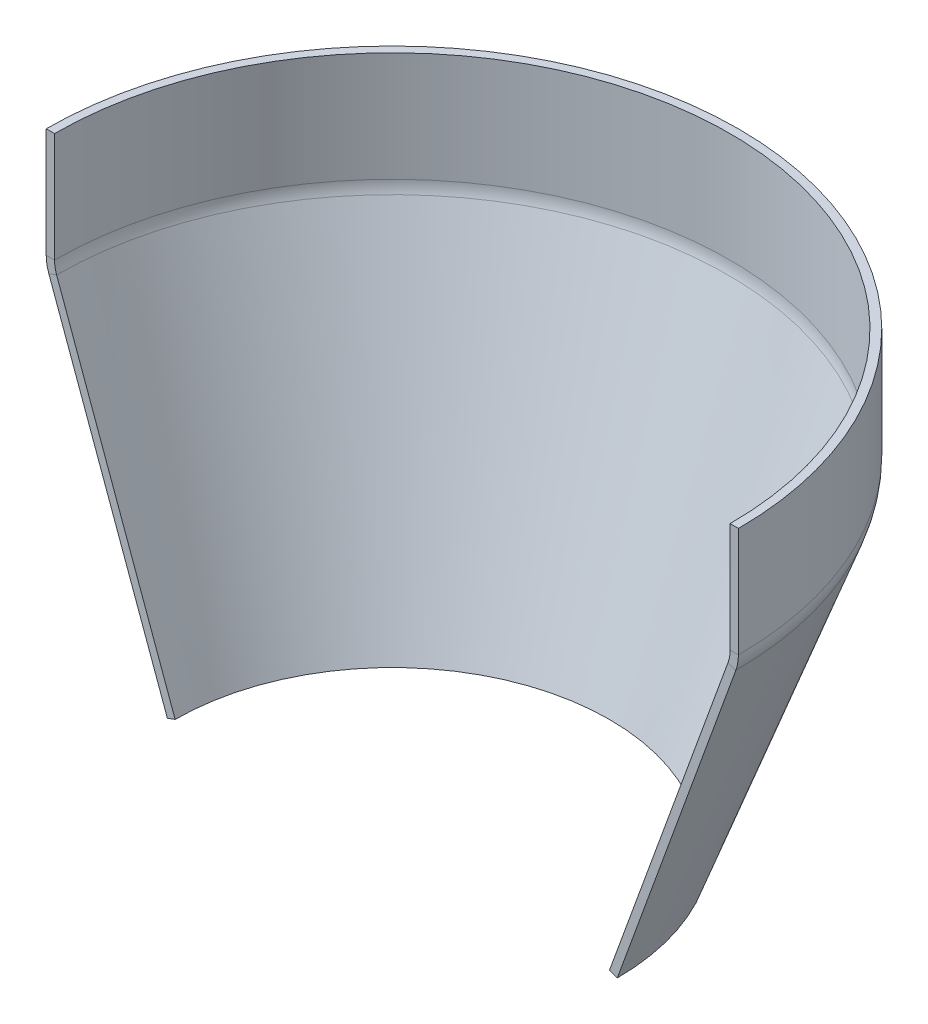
SolidWorks part; units mm, degrees
ref_plane "Front Plane" through (0, 0, 0) normal (0, 0, 1) x (1, 0, 0)
ref_plane "Top Plane" through (0, 0, 0) normal (0, 1, 0) x (1, 0, 0)
ref_plane "Right Plane" through (0, 0, 0) normal (1, 0, 0) x (0, 0, -1)
sketch "Sketch1" plane through (0, 0, 0) normal (0, 0, 1) x (1, 0, 0)
  line L0 (32.5, 0) -> (50, 48.0809)
  line L1 (50, 48.0809) -> (50, 65)
  line L2 (0, 0) -> (0, 51.3485) construction
  dimension "D1" = 100
  dimension "D2" = 65
  dimension "D3" = 65
  dimension "D4" = 20
sketch "Sketch2" plane through (0, 0, 0) normal (0, 1, 0) x (1, 0, 0)
  arc A0 (32.5, 0) -> (-32.5, 0) centre (0, 0) ccw
swept flange "Swept Flange1" thickness 1.2 parameters "D1"=5
other "Sweptbend1_1" parameters "D1"=5, "D4"=340, "D5"=1
other "Sweptbend2_1" parameters "D1"=5, "D4"=180, "D5"=2
sketch "Bend-Lines1" [suppressed] plane through (0, 0, 0) normal (0, 1, 0) x (1, 0, 0)
sketch "Bounding-Box1" [suppressed] plane through (0, 0, 0) normal (0, 1, 0) x (1, 0, 0)
sheet metal parameters "Sheet-Metal1" thickness 1.2 parameters "D1"=5
flat pattern "Flat-Pattern1"
sketch "Bend-Lines2" plane through (28.6982, -10.4453, 0) normal (0.9397, -0.342, 0) x (0, 0, -1)
  line L0 (50.1084, 11.1157) -> (50.1084, 78.9697) construction
  line L1 (0, 62.1664) -> (100.2168, 62.1664) construction
sketch3d "Bounding-Box2" [suppressed]
  line L0 (0, 67.854, 0) -> (100.2168, 67.854, 0) construction
  line L1 (0, 0, 0) -> (100.2168, 0, 0) construction
  line L2 (0, 67.854, 0) -> (0, 0, 0) construction
  line L3 (100.2168, 67.854, 0) -> (100.2168, 0, 0) construction
bend of the flat pattern "Flatten-<Sweptbend1_1>1"
bend of the flat pattern "Flatten-<Sweptbend2_1>1"
